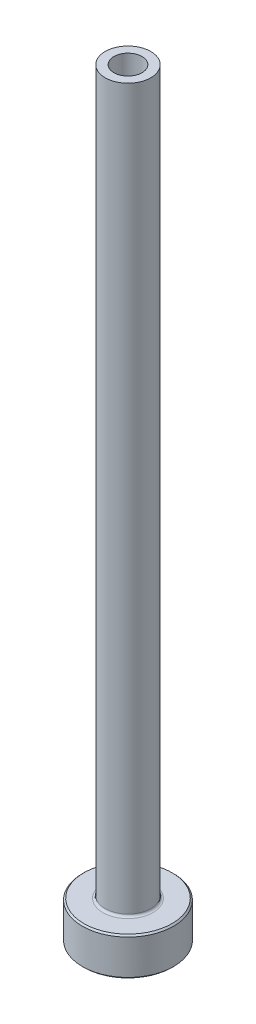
SolidWorks part; units mm, degrees
ref_plane "Front Plane" through (0, 0, 0) normal (0, 0, 1) x (1, 0, 0)
ref_plane "Top Plane" through (0, 0, 0) normal (0, 1, 0) x (1, 0, 0)
ref_plane "Right Plane" through (0, 0, 0) normal (1, 0, 0) x (0, 0, -1)
sketch "Sketch1" plane through (0, 0, 0) normal (0, 0, 1) x (1, 0, 0)
  line L0 (-1.85, 100) -> (-3, 100)
  line L1 (-3, 100) -> (-3, 5)
  line L2 (-3, 5) -> (-6, 5)
  line L3 (-6, 5) -> (-6, 0)
  line L4 (6.6, 0) -> (-6.6, 0) construction
  line L5 (-6, 0) -> (-2.1, 0)
  line L6 (-1.85, 55) -> (-1.85, 100)
  line L7 (0, 92.1877) -> (0, -15.5353) construction
  line L8 (0, -6.6) -> (0, 6.6) construction
  line L9 (-1.85, 55) -> (-2.1, 43)
  line L10 (-2.1, 43) -> (-2.1, 0)
  dimension "D1" = 0.25
  dimension "ID" = 3.7
  dimension "OD" = 6
  dimension "L" = 100
  dimension "H" = 12
  dimension "T" = 5
  dimension "N" = 45
  dimension "D2" = 12
revolve "Revolve1" add sketch "Sketch1" angle 360 about L7
fillet "Fillet1" radius 0.3 1 edges at (0, 5, 3)
chamfer "Chamfer1" distance 0.2 angle 45 2 edges at (0, 5, 6) (0, 0, 6)
chamfer "Chamfer3" distance 0.5 angle 45 1 edges at (0, 0, 2.1)
